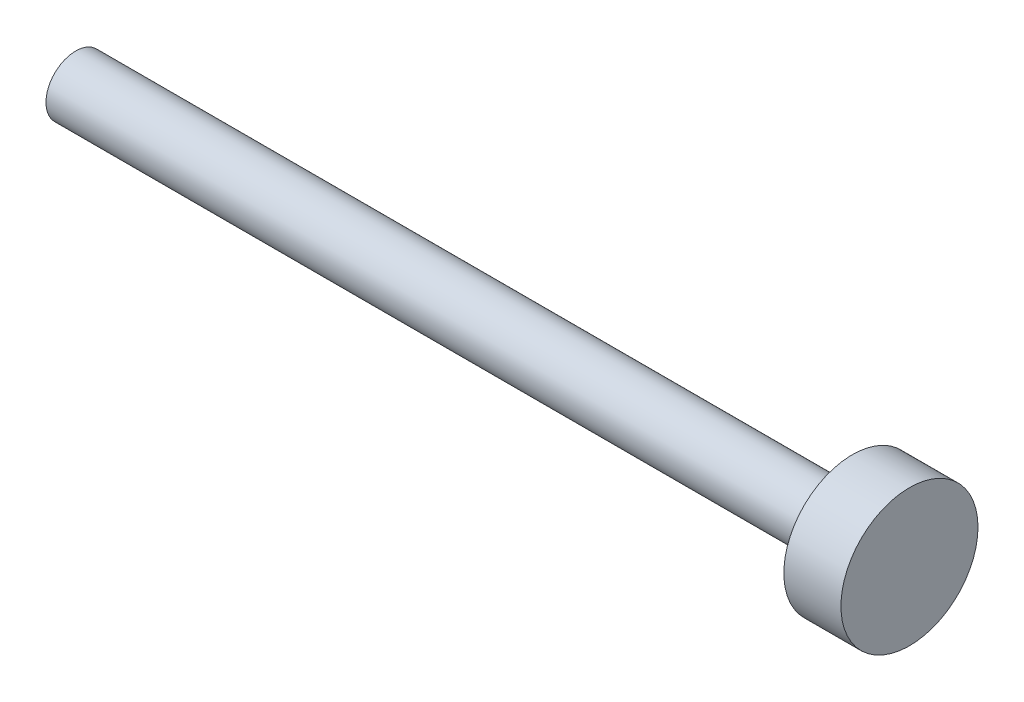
SolidWorks part; units mm, degrees
ref_plane "Front Plane" through (0, 0, 0) normal (0, 0, 1) x (1, 0, 0)
ref_plane "Top Plane" through (0, 0, 0) normal (0, 1, 0) x (1, 0, 0)
ref_plane "Right Plane" through (0, 0, 0) normal (1, 0, 0) x (0, 0, -1)
sketch "Sketch1" plane through (0, 0, 0) normal (1, 0, 0) x (0, 0, -1)
  circle A0 centre (0, 0) radius 1.651
extrude "Boss-Extrude1" add sketch "Sketch1" along normal blind 43.18
sketch "Sketch2" plane through (43.18, 0, 0) normal (1, 0, 0) x (0, 0, -1)
  circle A0 centre (0, 0) radius 3.81
extrude "Boss-Extrude2" add sketch "Sketch2" along normal blind 3.175
